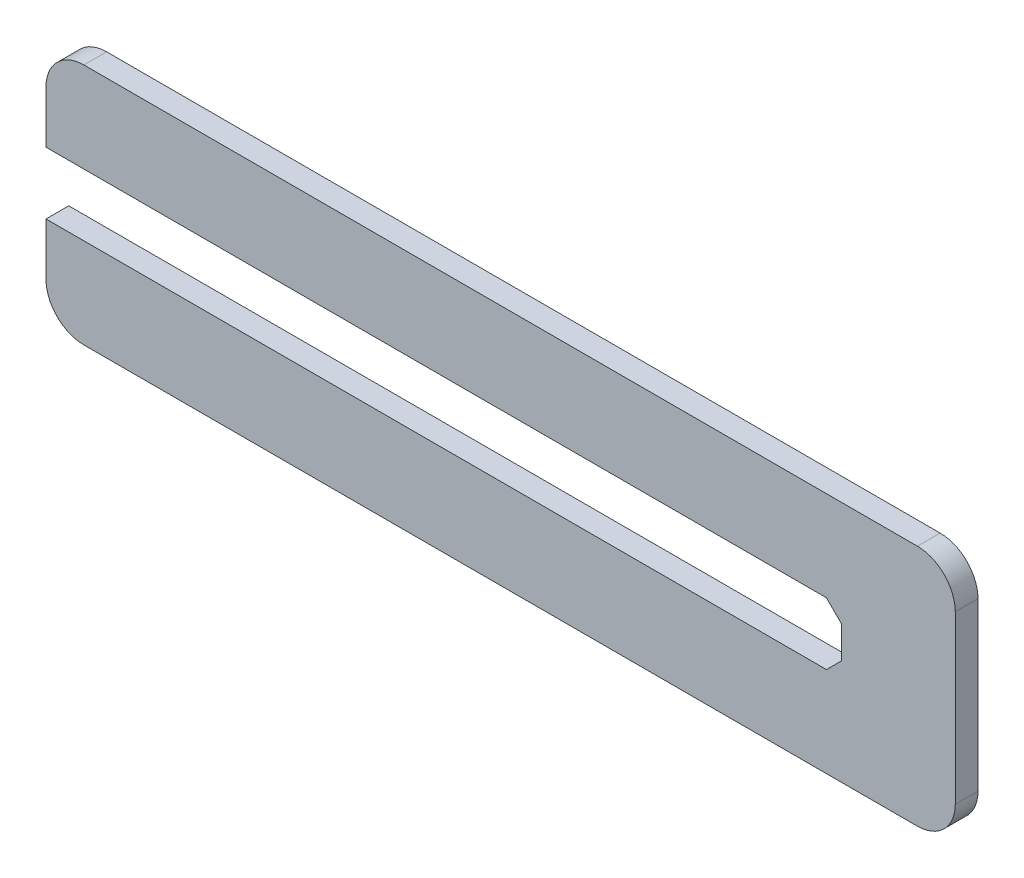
SolidWorks part; units mm, degrees
ref_plane "Plan de face" through (0, 0, 0) normal (0, 0, 1) x (1, 0, 0)
ref_plane "Plan de dessus" through (0, 0, 0) normal (0, 1, 0) x (1, 0, 0)
ref_plane "Plan de droite" through (0, 0, 0) normal (1, 0, 0) x (0, 0, -1)
sketch "Esquisse1" plane through (0, 0, 0) normal (0, 0, 1) x (1, 0, 0)
  line L1 (0, 0) -> (120, 0)
  line L2 (0, 0) -> (0, 32)
  line L3 (0, 32) -> (120, 32)
  line L4 (120, 0) -> (120, 32)
  dimension "D1" = 120
  dimension "D2" = 32
extrude "Extrusion1" add sketch "Esquisse1" along normal blind 3
sketch "Esquisse2" plane through (0, 0, 3) normal (0, 0, 1) x (1, 0, 0)
  line L0 (0, 32) -> (0, 0) construction
  line L1 (0, 20.1) -> (105, 20.1)
  line L2 (0, 20.1) -> (0, 11.9)
  line L3 (0, 11.9) -> (105, 11.9)
  line L4 (105, 20.1) -> (105, 11.9)
  line L6 (0, 0) -> (120, 0) construction
  line L7 (120, 0) -> (120, 32) construction
  dimension "D1" = 15
  dimension "D3" = 11.9
  dimension "D4" = 8.2
extrude "Extrusion2" cut sketch "Esquisse2" against normal blind 3
chamfer "Chanfrein1" distance 2 angle 45 2 edges at (105, 20.1, 1.5) (105, 11.9, 1.5)
fillet "Congé1" radius 5 4 edges at (120, 0, 1.5) (0, 0, 1.5) (0, 32, 1.5) (120, 32, 1.5)
